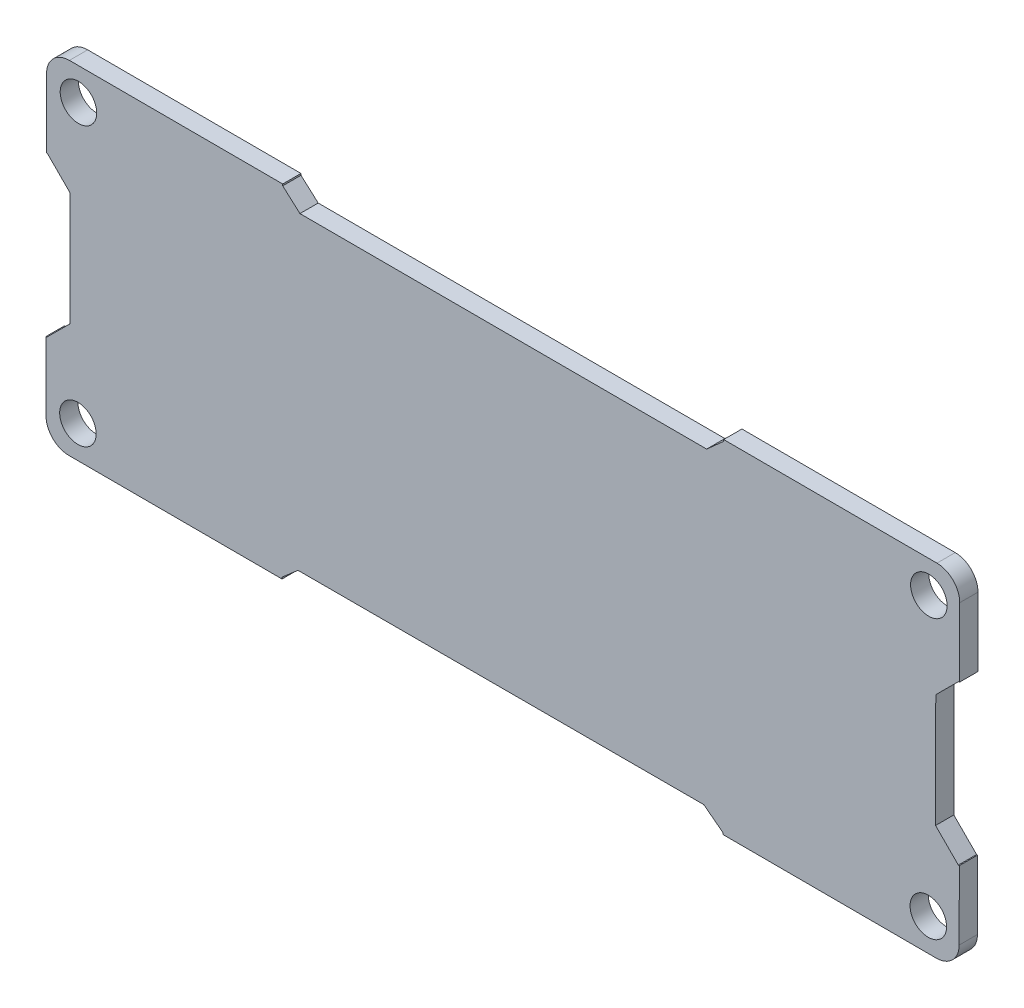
SolidWorks part; units mm, degrees
ref_plane "Alzado" through (0, 0, 0) normal (0, 0, 1) x (1, 0, 0)
ref_plane "Planta" through (0, 0, 0) normal (0, 1, 0) x (1, 0, 0)
ref_plane "Vista lateral" through (0, 0, 0) normal (1, 0, 0) x (0, 0, -1)
sketch "Croquis1" plane through (0, 0, 0) normal (0, 0, 1) x (1, 0, 0)
  line B0 (-0.6776, 17.1386) -> (-2.6739, 19.1424)
  line B1 (-2.7589, 19.1426) -> (-2.7475, 25.1752)
  line B2 (-0.7437, 27.1715) -> (17.9416, 27.1362)
  line B3 (-0.6964, 7.204) -> (-0.6776, 17.1386)
  line B4 (-2.7002, 5.2078) -> (-0.6964, 7.204)
  line B5 (-2.7852, 5.2079) -> (-2.7002, 5.2078)
  line B6 (-2.7966, -0.8247) -> (-2.7852, 5.2079)
  line B7 (17.885, -2.8638) -> (-0.8003, -2.8285)
  line B8 (17.8852, -2.7224) -> (17.885, -2.8638)
  line B9 (19.2754, -1.5068) -> (17.8852, -2.7224)
  line B10 (54.8317, -1.5068) -> (19.2754, -1.5068)
  line B11 (56.5145, -2.7954) -> (54.8317, -1.5068)
  line B12 (56.5142, -2.9367) -> (56.5145, -2.7954)
  line B13 (75.1995, -2.972) -> (56.5142, -2.9367)
  line B14 (77.2147, 5.0569) -> (77.2033, -0.9758)
  line B15 (77.1297, 5.057) -> (77.2147, 5.0569)
  line B16 (75.1335, 7.0608) -> (77.1297, 5.057)
  line B17 (75.1522, 16.9955) -> (75.1335, 7.0608)
  line B18 (77.241, 18.9915) -> (77.156, 18.9917)
  line B19 (77.156, 18.9917) -> (75.1522, 16.9955)
  line B20 (77.2524, 25.0242) -> (77.241, 18.9915)
  line B21 (56.5709, 27.0632) -> (75.2562, 27.028)
  line B22 (56.5706, 26.9219) -> (56.5709, 27.0632)
  line B23 (55.079, 25.5924) -> (56.5706, 26.9219)
  line B24 (19.4504, 25.6449) -> (55.079, 25.5924)
  line B25 (17.9413, 26.9948) -> (19.4504, 25.6449)
  arc B26 (-0.7437, 27.1715) -> (-2.7475, 25.1752) centre (-0.7475, 25.1715) ccw
  arc B27 (75.2562, 27.028) -> (77.2524, 25.0242) centre (75.2524, 25.028) cw
  arc B28 (77.2033, -0.9758) -> (75.1995, -2.972) centre (75.2033, -0.972) cw
  arc B29 (-2.7966, -0.8247) -> (-0.8003, -2.8285) centre (-0.7966, -0.8285) ccw
  circle B30 centre (74.5449, 24.2363) radius 1.6
  circle B31 centre (0, 0) radius 1.6
  circle B32 centre (0.046, 24.377) radius 1.6
  circle B33 centre (74.4989, -0.1407) radius 1.6
  line B34 (17.9416, 27.1362) -> (17.9413, 26.9948)
  line B35 (-2.6739, 19.1424) -> (-2.7589, 19.1426)
sketch_block_instance "blk_xmotion-1"
sketch_block "blk_xmotion" parameters "D1"=0.1413
extrude "Saliente-Extruir1" add sketch "Croquis1" along normal blind 1.6
